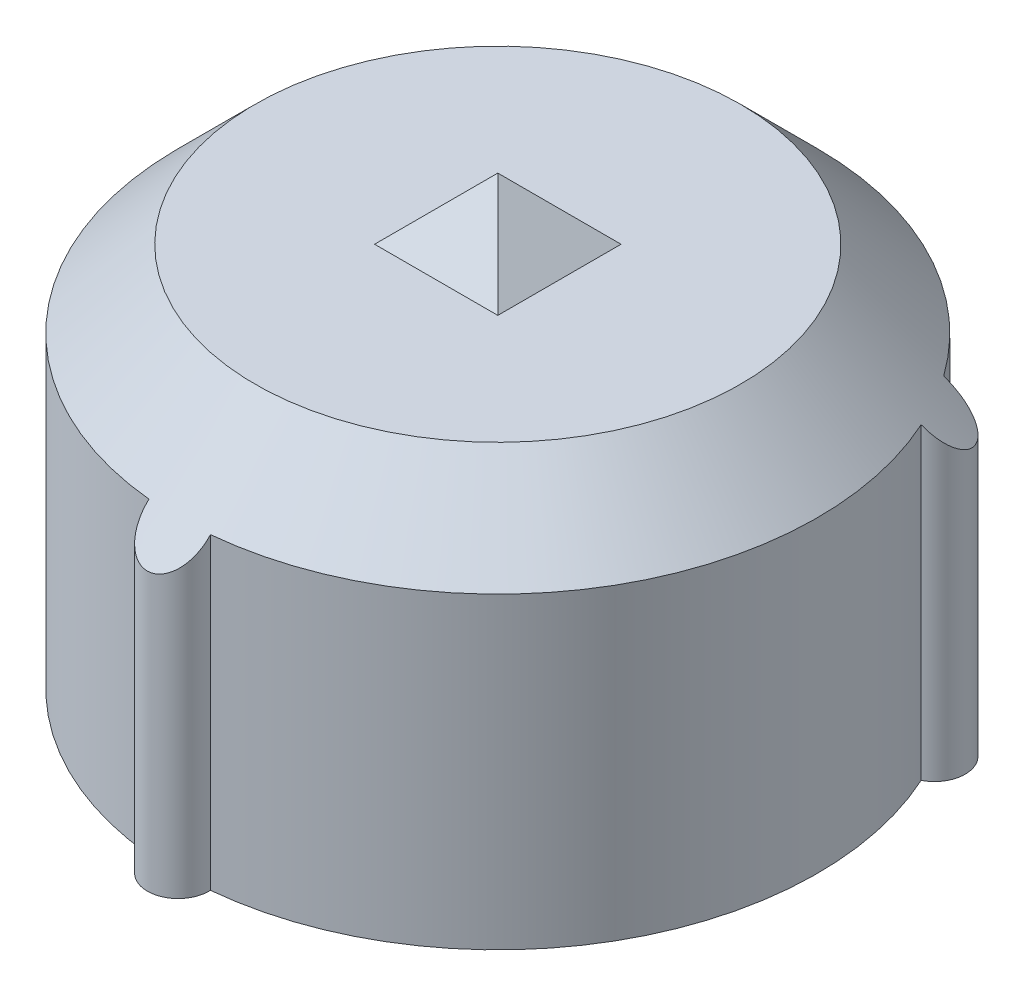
SolidWorks part; units mm, degrees
ref_plane "Front Plane" through (0, 0, 0) normal (0, 0, 1) x (1, 0, 0)
ref_plane "Top Plane" through (0, 0, 0) normal (0, 1, 0) x (1, 0, 0)
ref_plane "Right Plane" through (0, 0, 0) normal (1, 0, 0) x (0, 0, -1)
sketch "Sketch1" plane through (0, 0, 0) normal (0, 0, 1) x (1, 0, 0)
  line L0 (0, 0) -> (0, -66.2626) construction
  line L1 (0, 0) -> (4.55, 0)
  line L2 (4.55, 0) -> (4.55, 5)
  line L4 (4.55, 5) -> (0, 5)
  line L5 (0, 5) -> (0, 0)
  dimension "D1" = 5
  dimension "D2" = 9.1
revolve "Revolve1" add sketch "Sketch1" angle 360 about L0
sketch "Sketch2" plane through (0, 0, 0) normal (0, 1, 0) x (1, 0, 0)
  line L0 (0, 0) -> (0, -5.5148) construction
  line L1 (0, 0) -> (-5.4284, 3.1341) construction
  line L2 (0, 0) -> (5.592, 3.2286) construction
  arc A0 (0.3995, -4.1307) -> (3.7771, 1.7194) centre (0, 0) ccw
  circle A1 centre (0, 0) radius 5.05
  arc A3 (-0.3995, -4.1307) -> (0.3995, -4.1307) centre (0, -4.15) ccw
  arc A4 (-3.3775, 2.4114) -> (-3.7771, 1.7194) centre (-3.594, 2.075) ccw
  arc A5 (-3.7771, 1.7194) -> (-0.3995, -4.1307) centre (0, 0) ccw
  arc A6 (3.7771, 1.7194) -> (3.3775, 2.4114) centre (3.594, 2.075) ccw
  arc A7 (3.3775, 2.4114) -> (-3.3775, 2.4114) centre (0, 0) ccw
  circle A8 centre (0, 0) radius 4.55 construction
  dimension "D1" = 8.3
  dimension "D2" = 0.5
  dimension "D3" = 120
  dimension "D4" = 120
extrude "Extrude1" cut sketch "Sketch2" along normal through all
sketch "Sketch4" plane through (0, 0, 0) normal (0, 1, 0) x (1, 0, 0)
  line L0 (0, 0) -> (4.9919, 0) construction
  line L1 (0, 0) -> (3.8331, -3.8331) construction
  dimension "D1" = 45
ref_plane "Plane1" through (0, 0, 0) normal (0.7071, 0, 0.7071) x (0.7071, 0, -0.7071)
sketch "Sketch6" [suppressed] plane through (0, 0, 0) normal (1, 0, 0) x (0, 0, -1)
  line L0 (0, 0) -> (0, 4.8917) construction
  line L2 (-8.45, 1) -> (-8.45, 5)
  line L3 (-8.45, 5) -> (-4.45, 5)
  line L4 (-4.45, 5) -> (-8.45, 1)
  point P5 (-5.95, 3.5)
  dimension "D1" = 5
  dimension "D2" = 6.3
  dimension "D3" = 45
  dimension "D4" = 1
  dimension "D5" = 1
revolve "Cut-Revolve1" [suppressed] cut sketch "Sketch6" angle 360 about L0
sketch "Sketch5" [suppressed] plane through (0, 0, 0) normal (0, 0, 1) x (1, 0, 0)
  line L0 (1.5, 5) -> (0, 3.5)
  line L2 (0, 3.5) -> (-1.5, 5)
  line L3 (-1.5, 5) -> (1.5, 5)
  line L4 (0, 3.5) -> (0, 5) construction
  line L5 (-0.3998, 5) -> (-6.3, 5) construction
  dimension "D1" = 2
extrude "Extrude2" [suppressed] cut sketch "Sketch5" against normal through all and the other way through all
pattern_linear "LPattern1" [suppressed] count 8 spacing 2 along (1, 0, 0) count 8 spacing 2 along (1, 0, 0)
mirror "Mirror1" [suppressed] about plane through (0, 0, 0) normal (0.7071, 0, 0.7071)
sketch "Sketch7" plane through (0, 0, 0) normal (0, 1, 0) x (1, 0, 0)
  line L1 (-0.8, 0.8) -> (0.8, 0.8)
  line L2 (-0.8, 0.8) -> (-0.8, -0.8)
  line L3 (-0.8, -0.8) -> (0.8, -0.8)
  line L4 (0.8, 0.8) -> (0.8, -0.8)
  line L5 (-0.8, 0.8) -> (0.8, -0.8) construction
  line L6 (-0.8, -0.8) -> (0.8, 0.8) construction
  point P0 (0, 0)
  dimension "D1" = 1.6
extrude "Extrude3" add sketch "Sketch7" along normal blind 5.8
draft "Draft1" type of draft neutral plane draft angle 45 faces to draft 4 parameters "D1"=45
sketch "Sketch8" plane through (0, 0, 0) normal (0, 0, 1) x (1, 0, 0)
  line L0 (0, 0) -> (0, 4.8917) construction
  line L2 (-7.15, 1) -> (-7.15, 5)
  line L3 (-7.15, 5) -> (-3.15, 5)
  line L4 (-3.15, 5) -> (-7.15, 1)
  dimension "D1" = 5
  dimension "D2" = 6.3
  dimension "D3" = 45
  dimension "D4" = 1
revolve "Cut-Revolve3" cut sketch "Sketch8" angle 360 about L0
